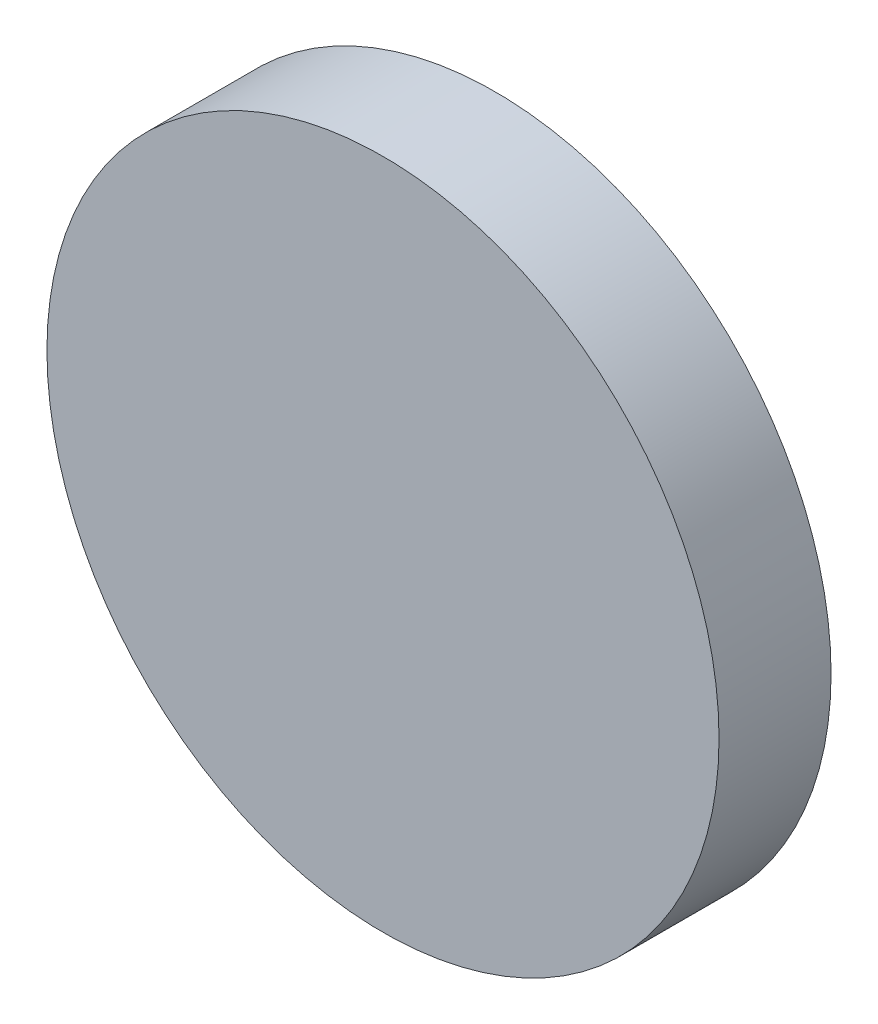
SolidWorks part; units mm, degrees
ref_plane "Front Plane" through (0, 0, 0) normal (0, 0, 1) x (1, 0, 0)
ref_plane "Top Plane" through (0, 0, 0) normal (0, 1, 0) x (1, 0, 0)
ref_plane "Right Plane" through (0, 0, 0) normal (1, 0, 0) x (0, 0, -1)
sketch "Sketch1" plane through (0, 0, 0) normal (0, 0, 1) x (1, 0, 0)
  circle A0 centre (0, 0) radius 19.05
extrude "Extrude1" add sketch "Sketch1" along normal blind 6.35
